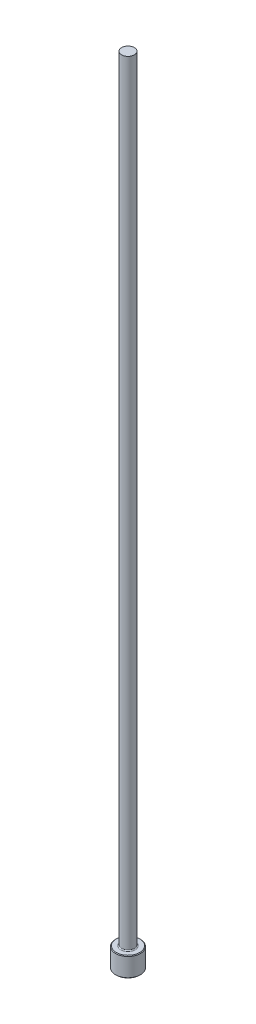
SolidWorks part; units mm, degrees
ref_plane "Front Plane" through (0, 0, 0) normal (0, 0, 1) x (1, 0, 0)
ref_plane "Top Plane" through (0, 0, 0) normal (0, 1, 0) x (1, 0, 0)
ref_plane "Right Plane" through (0, 0, 0) normal (1, 0, 0) x (0, 0, -1)
other "Configuration Table"
sketch "Sketch1" plane through (0, 0, 0) normal (0, 0, 1) x (1, 0, 0)
  line L0 (0, 259.9588) -> (0, -15.1925) construction
  line L1 (0, 0) -> (-0.9906, 0)
  line L2 (-0.9906, 0) -> (-0.9906, 1.5748)
  line L3 (-0.9906, 1.5748) -> (-0.508, 1.5748)
  line L4 (-0.508, 1.5748) -> (-0.508, 63.5)
  line L5 (-0.508, 63.5) -> (0, 63.5)
  line L6 (0, 63.5) -> (0, 0)
  dimension "L" = 63.5
  dimension "H" = 1.9812
  dimension "T" = 1.5748
  dimension "D" = 1.016
revolve "Revolve1" add sketch "Sketch1" angle 360 about L0
chamfer "Chamfer1" distance 0.0508 angle 45 2 edges at (0, 1.5748, 0.9906) (0, 0, 0.9906)
fillet "Fillet1" radius 0.0762 1 edges at (0, 1.5748, 0.508)
